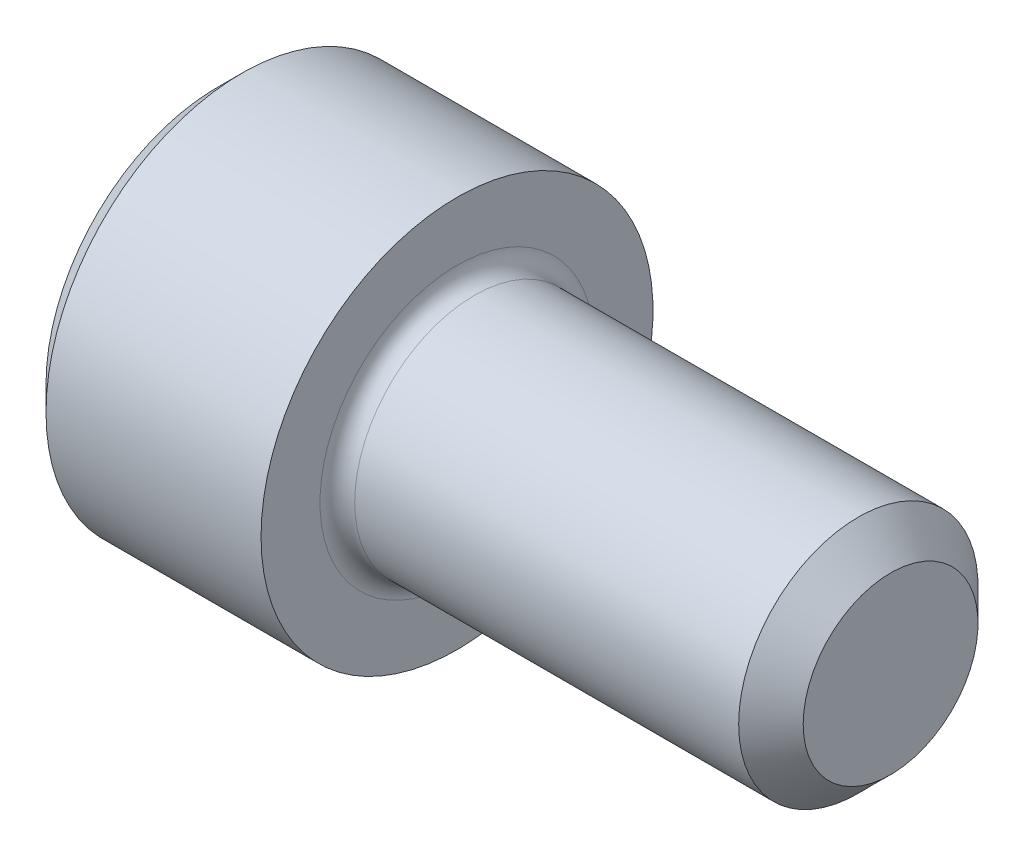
SolidWorks part; units mm, degrees
revolve "Base-Revolve" add sketch "BodySke"
sketch "BodySke" plane through (0, 0, 0) normal (0, 0, 1) x (1, 0, 0)
  line L0 (0, 0) -> (0, 2.5146)
  line L1 (0.3556, 2.8702) -> (3.5052, 2.8702)
  line L2 (3.5052, 2.8702) -> (3.5052, 1.7526)
  line L3 (3.5052, 1.7526) -> (9.3828, 1.7526)
  line L4 (9.8552, 1.2802) -> (9.8552, 0)
  line L5 (9.8552, 0) -> (0, 0)
  line L6 (-31.75, 0) -> (127, 0) construction
  line L7 (0, 2.5146) -> (0.3556, 2.8702)
  line L8 (9.8552, 1.2802) -> (9.3828, 1.7526)
  line L9 (0, -2.5146) -> (0.3556, -2.8702) construction
  line L10 (9.8552, -1.2802) -> (9.3828, -1.7526) construction
  line L11 (4.2977, 9.525) -> (4.2977, 3.175) construction
  line L12 (3.5052, 9.525) -> (3.5052, 3.175) construction
  line L13 (-28.2448, 9.525) -> (-28.2448, 3.175) construction
  dimension "Diameter" = 3.5052
  dimension "Head_ht" = 3.5052
  dimension "Length" = 6.35
  dimension "Body_ch_ang" = 45
  dimension "Head_dia" = 5.7404
  dimension "Head_ch_ang" = 45
  dimension "Head_side_ht" = 3.1496
  dimension "Minor_dia" = 2.5603
  dimension "Advance" = 0.7925
  dimension "Thread_nom" = 6.35
  dimension "Thread_length" = 38.1
fillet "Fillet1" radius 0.254 1 edges at (3.5052, 0, 1.7526)
ref_plane "Plane1" through (0, 0, 0) normal (0, 0, 1) x (1, 0, 0)
ref_plane "Plane2" through (0, 0, 0) normal (0, 1, 0) x (1, 0, 0)
ref_plane "Plane3" through (0, 0, 0) normal (1, 0, 0) x (0, 0, -1)
sketch "Sketch2" plane through (0, 0, 0) normal (0, 0, 1) x (1, 0, 0)
  line L0 (0, 1.3843) -> (1.6256, 1.3843)
  line L1 (1.6256, 1.3843) -> (2.4248, 0)
  line L2 (-31.75, 0) -> (127, 0) construction
  line L3 (2.4248, 0) -> (0, 0)
  line L4 (0, 0) -> (0, 1.3843)
  line L5 (0, 2.5146) -> (0, -2.5146) construction
  line L6 (0, 0) -> (47.625, 0) construction
  line L7 (3.5052, -2.8702) -> (3.5052, 2.8702) construction
revolve "Hex-PreBroach" cut sketch "Sketch2" angle 360 about L6
sketch "Sketch3" plane through (0, 0, 0) normal (-1, 0, 0) x (0, 0.5, 0.866)
  line L0 (0.7992, 1.3843) -> (-0.7992, 1.3843)
  line L1 (-0.7992, 1.3843) -> (-1.5985, 0)
  line L2 (0.7992, 1.3843) -> (1.5985, 0)
  line L3 (0.7992, -1.3843) -> (1.5985, 0)
  line L4 (0.7992, -1.3843) -> (-0.7992, -1.3843)
  line L5 (-0.7992, -1.3843) -> (-1.5985, 0)
extrude "Hex" cut sketch "Sketch3" against normal blind 1.6256
sketch "Sketch4" plane through (0, 0, 0) normal (-1, 0, 0) x (0, 0, 1)
  line L0 (0, 0) -> (1.7399, 0)
  line L1 (0, 0) -> (6.1484, 3.5498) construction
  line L2 (0, 0) -> (0.8699, 1.5068)
  line L3 (1.4457, 0.3947) -> (1.6607, 0.5189)
  line L4 (1.0647, 1.0546) -> (1.2797, 1.1788)
  arc A0 (1.4457, 0.3947) -> (1.0647, 1.0546) centre (0, 0) ccw
  arc A1 (1.7399, 0) -> (1.6607, 0.5189) centre (0, 0) ccw
  arc A2 (0.8699, 1.5068) -> (1.2797, 1.1788) centre (0, 0) cw
extrude "Spline" [suppressed] cut sketch "Sketch4" against normal blind 1.6256
pattern_circular "CirPattern1" [suppressed] count 6 every 60
sketch "Sketch5" plane through (0, 0, 0) normal (0, 0, 1) x (1, 0, 0)
  line L0 (-31.75, 0) -> (127, 0) construction
  line L2 (0, 2.5146) -> (0, -2.5146) construction
  circle A0 centre (1.27, 0) radius 0.4445
  dimension "Drilled_hole_dia" = 0.889
  dimension "Drilled_hole_loc" = 1.27
extrude "Hole" [suppressed] cut sketch "Sketch5" against normal through all and the other way through all
pattern_circular "Drilled-4" [suppressed] count 2 every 60
pattern_circular "Drilled-6" [suppressed] count 3 every 60
sketch "ThdSchSke" plane through (0, 0, 0) normal (0, 0, 1) x (1, 0, 0)
  line L0 (4.2977, -1.2802) -> (3.9669, -1.7526)
  line L1 (4.2977, -1.2802) -> (4.6285, -1.7526)
  line L2 (4.6285, -1.7526) -> (4.6285, -2.1907)
  line L3 (-3.175, 0) -> (5.1513, 0) construction
  line L5 (4.6285, -2.1907) -> (3.9669, -2.1907)
  line L6 (3.9669, -2.1907) -> (3.9669, -1.7526)
  line L7 (0, 2.5146) -> (0, -2.5146) construction
revolve "ThreadSchematic" [suppressed] cut sketch "ThdSchSke" angle 360 about L3
pattern_linear "ThdSchPat" [suppressed]
equation "\"D2@Sketch3\" = \"Hex_size@Sketch3\" / 2"
equation "\"D1@Sketch3\" = \"Hex_size@Sketch3\" / 2"
equation "\"D1@Sketch2\" = \"Hex_size@Sketch3\" / 2"
equation "\"D3@Sketch4\" = \"Spline_p_dim@Sketch4\" / 2"
equation "\"Thread_minor@ThreadCosmetic\"  =  \"Minor_dia@BodySke\""
equation "\"D2@CirPattern1\" = 360 / \"Num_teeth@CirPattern1\""
equation "\"Wall_thickness@Sketch2\" = \"Head_ht@BodySke\" - \"Key_eng@Hex\""
equation "\"Thread_length@ThreadCosmetic\" = ((sgn( (\"Length@BodySke\" - \"Advance@BodySke\" ) - \"Thread_nom@BodySke\" )-1)*( (\"Length@BodySke\" - \"Advance@BodySke\" ) - \"Thread_nom@BodySke\" ))/-2+ \"Thread_nom@BodySke\""
equation "\"Thread_minor@ThdSchSke\" = \"Minor_dia@BodySke\""
equation "\"Diameter@ThdSchSke\" = \"Diameter@BodySke\""
equation "\"Overcut@ThdSchSke\" = \"Diameter@BodySke\" * 1.25"
equation "\"Start@ThdSchSke\" = \"Head_ht@BodySke\" + \"Length@BodySke\" - \"Thread_length@ThreadCosmetic\"  '---Non-countersunk---"
equation "\"Num_threads@ThdSchPat\" = int( \"Thread_length@ThreadCosmetic\" / \"Advance@BodySke\" + 0.999 )  + 1"
equation "\"Advance@ThdSchPat\" = \"Thread_length@ThreadCosmetic\" /  (\"Num_threads@ThdSchPat\" - 1) 'relax it"
equation "\"Num_threads@ThdSchPat\" = \"Num_threads@ThdSchPat\" - sgn( \"Num_threads@ThdSchPat\" - 1) '---chamfered tips only---"
